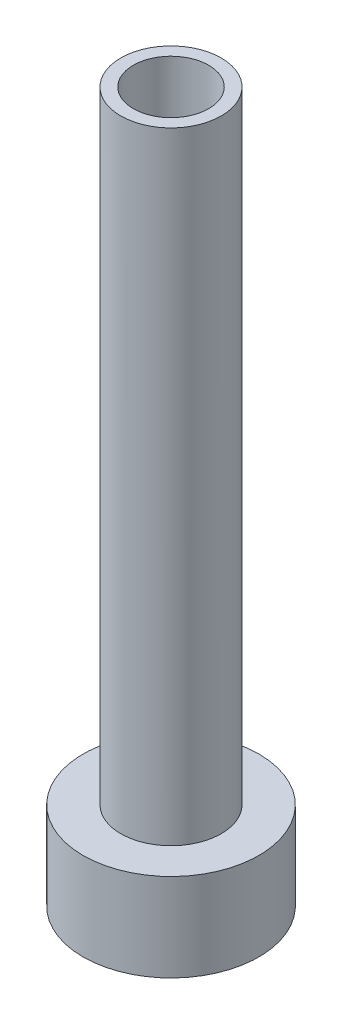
SolidWorks part; units mm, degrees
ref_plane "Plan de face" through (0, 0, 0) normal (0, 0, 1) x (1, 0, 0)
ref_plane "Plan de dessus" through (0, 0, 0) normal (0, 1, 0) x (1, 0, 0)
ref_plane "Plan de droite" through (0, 0, 0) normal (1, 0, 0) x (0, 0, -1)
sketch "Esquisse1" plane through (0, 0, 0) normal (0, 0, 1) x (1, 0, 0)
  line L0 (0, 0) -> (0, 67.7263) construction
  line L1 (-3, 0) -> (-7, 0)
  line L2 (11, 0) -> (-11, 0) construction
  line L3 (-7, 0) -> (-7, 7)
  line L4 (-7, 7) -> (-4, 7)
  line L5 (-4, 7) -> (-4, 75)
  line L6 (-4, 75) -> (-3, 75)
  line L7 (-3, 75) -> (-3, 0)
  dimension "D1" = 14
  dimension "D2" = 8
  dimension "D3" = 7
  dimension "D4" = 6
  dimension "D5" = 75
revolve "Révolution1" add sketch "Esquisse1" angle 360 about L0
sketch "Esquisse2" plane through (0, 0, 0) normal (0, 1, 0) x (1, 0, 0)
  circle A0 centre (0, 0) radius 3.25
  dimension "D1" = 6.5
extrude "Enlèv. mat.-Extru.1" cut sketch "Esquisse2" along normal blind 29
chamfer "Chanfrein1" distance 1 angle 45 1 edges at (0, 0, 3.25)
sketch "Esquisse3" plane through (0, 75, 0) normal (0, 1, 0) x (1, 0, 0)
  circle A0 centre (0, 0) radius 4 construction
  circle A1 centre (0, 0) radius 4
sketch "Esquisse4" plane through (0, 75, 0) normal (0, 1, 0) x (1, 0, 0)
  circle A0 centre (0, 0) radius 4 construction
  circle A1 centre (0, 0) radius 4
extrude "Enlèv. mat.-Extru.2" cut sketch "Esquisse4" against normal up to surface (18.5 mm away)
